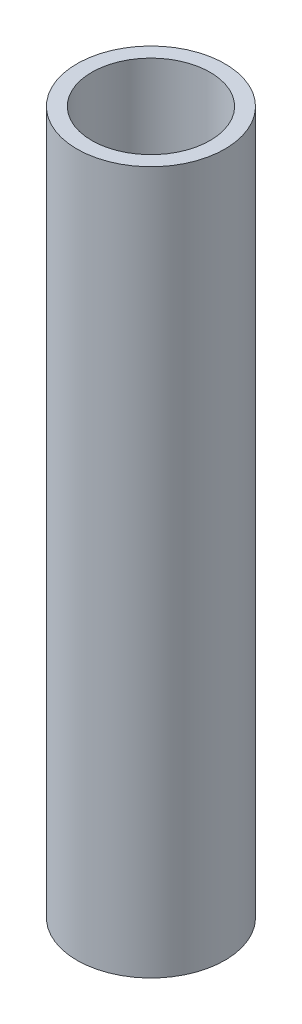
SolidWorks part; units mm, degrees
ref_plane "Front Plane" through (0, 0, 0) normal (0, 0, 1) x (1, 0, 0)
ref_plane "Top Plane" through (0, 0, 0) normal (0, 1, 0) x (1, 0, 0)
ref_plane "Right Plane" through (0, 0, 0) normal (1, 0, 0) x (0, 0, -1)
sketch "Sketch1" plane through (0, 0, 0) normal (0, 1, 0) x (1, 0, 0)
  circle A0 centre (0, 0) radius 10
  circle A1 centre (0, 0) radius 8
  dimension "D1" = 2
  dimension "D2" = 20
extrude "Boss-Extrude1" add sketch "Sketch1" along normal blind 95
